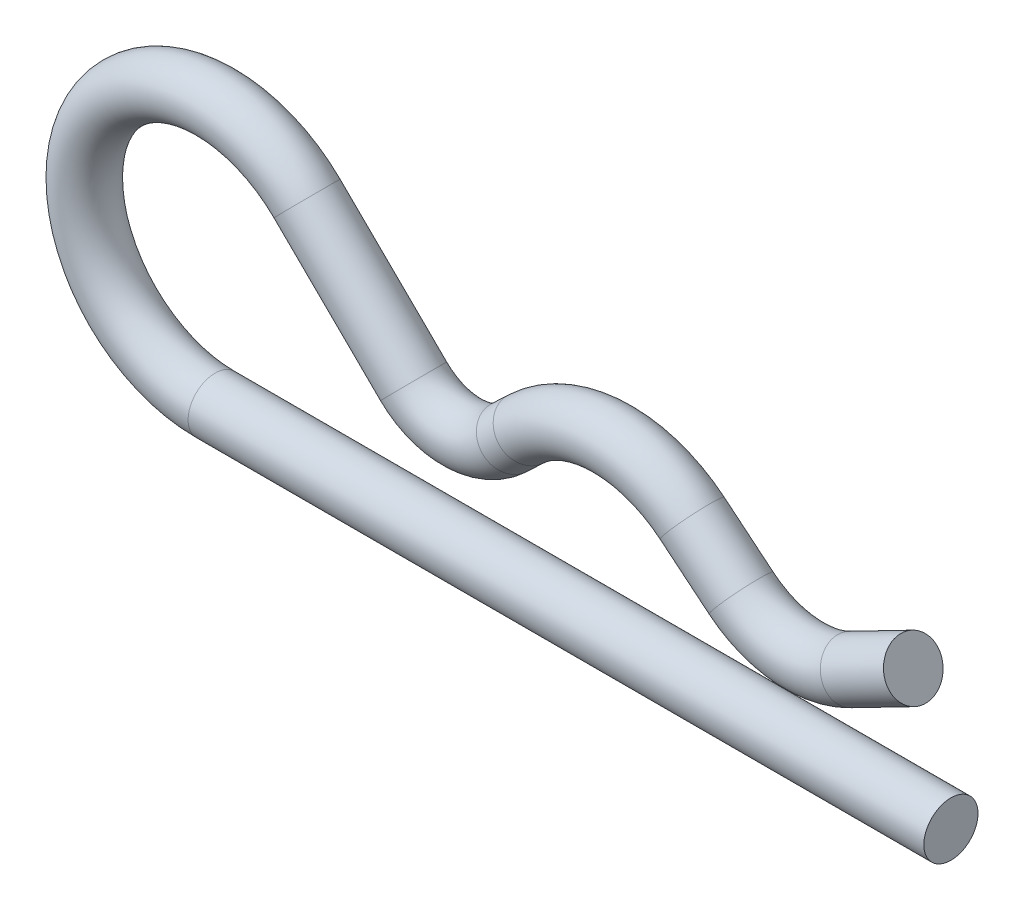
SolidWorks part; units mm, degrees
ref_plane "Front" through (0, 0, 0) normal (0, 0, 1) x (1, 0, 0)
ref_plane "Top" through (0, 0, 0) normal (0, 1, 0) x (1, 0, 0)
ref_plane "Right" through (0, 0, 0) normal (1, 0, 0) x (0, 0, -1)
sketch "Sketch1" plane through (0, 0, 0) normal (0, 0, 1) x (1, 0, 0)
  line L0 (0, 0) -> (-24.8412, 0)
  line L3 (-8.7348, 4.7218) -> (-7.0811, 3.3585)
  line L5 (-3.403, 2.9644) -> (-1.27, 4.064)
  line L7 (-14.912, 3.9899) -> (-14.345, 4.5274)
  line L8 (-21.739, 7.5675) -> (-18.1403, 4.0211)
  arc A0 (-24.8412, 0) -> (-21.739, 7.5675) centre (-24.8412, 4.4196) cw
  arc A4 (-7.0811, 3.3585) -> (-3.403, 2.9644) centre (-4.9431, 5.9519) ccw
  arc A5 (-14.345, 4.5274) -> (-8.7348, 4.7218) centre (-11.43, 1.4527) cw
  arc A6 (-18.1403, 4.0211) -> (-14.912, 3.9899) centre (-16.51, 5.6754) ccw
  arc A9 (-16.6034, 4.0231) -> (-16.4722, 4.0209) centre (-16.51, 5.6754) ccw construction
  arc A14 (-16.6034, 4.0231) -> (-16.4722, 4.0209) centre (-16.51, 5.6754) ccw construction
  dimension "D6" = 29.2608
  dimension "D7" = 1.27
  dimension "D2" = 16.51
  dimension "D3" = 4.9431
  dimension "D4" = 11.43
  dimension "D5" = 3.3528
  dimension "D8" = 2.5908
  dimension "D1" = 8.8392
  dimension "D9" = 4.064
sketch "Sketch2" plane through (0, 0, 0) normal (1, 0, 0) x (0, 0, -1)
  circle A0 centre (0, 0) radius 0.9144
  dimension "D1" = 1.8288
sweep "Base-Sweep" add profiles "Sketch2" path "Sketch1"
